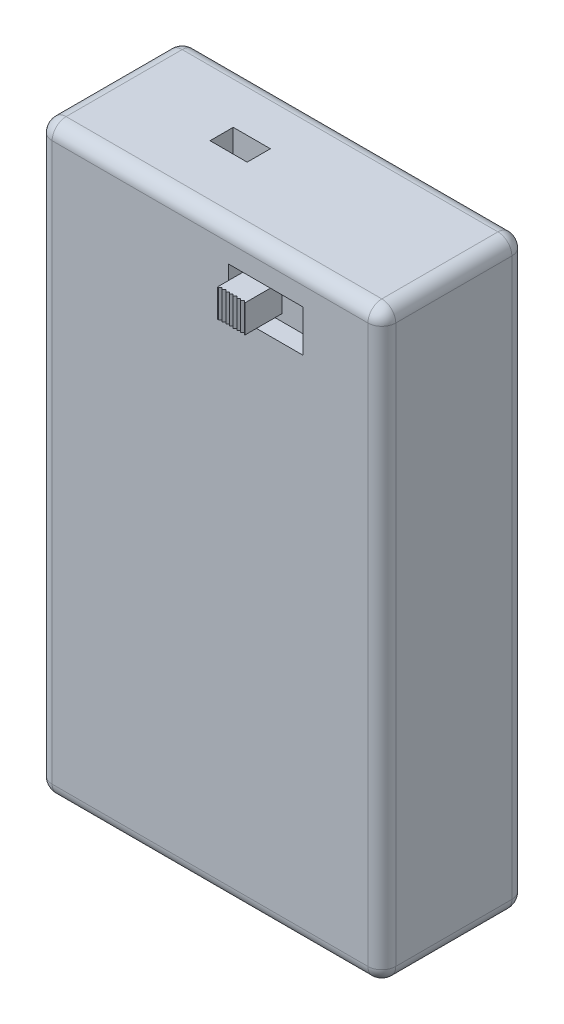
SolidWorks part; units mm, degrees
ref_plane "Plan de face" through (0, 0, 0) normal (0, 0, 1) x (1, 0, 0)
ref_plane "Plan de dessus" through (0, 0, 0) normal (0, 1, 0) x (1, 0, 0)
ref_plane "Plan de droite" through (0, 0, 0) normal (1, 0, 0) x (0, 0, -1)
sketch "Esquisse1" plane through (0, 0, 0) normal (0, 0, 1) x (1, 0, 0)
  line L1 (0, 0) -> (37, 0)
  line L2 (0, 0) -> (0, 63)
  line L3 (0, 63) -> (37, 63)
  line L4 (37, 0) -> (37, 63)
  dimension "D1" = 37
  dimension "D2" = 63
extrude "Boss.-Extru.1" add sketch "Esquisse1" along normal blind 15.5
fillet "Congé1" radius 1.5 12 edges at (0, 0, 7.75) (37, 0, 7.75) (37, 63, 7.75) (0, 63, 7.75) (18.5, 0, 0) (37, 31.5, 0) (18.5, 63, 0) (0, 31.5, 0) (18.5, 63, 15.5) (37, 31.5, 15.5) (18.5, 0, 15.5) (0, 31.5, 15.5)
sketch "Esquisse2" plane through (0, 0, 15.5) normal (0, 0, 1) x (1, 0, 0)
  line L0 (-3.9811, 59.5) -> (43.1878, 59.5) construction
  line L1 (-6.7395, 55) -> (55.4168, 55) construction
  line L2 (28.5, 65.5205) -> (28.5, 47.9586) construction
  line L3 (20.5, 65.5205) -> (20.5, 47.9586) construction
  line L4 (1.5, 63) -> (35.5, 63) construction
  line L5 (37, 61.5) -> (37, 1.5) construction
  line L7 (20.5, 59.5) -> (28.5, 59.5)
  line L8 (20.5, 59.5) -> (20.5, 55)
  line L9 (20.5, 55) -> (28.5, 55)
  line L10 (28.5, 59.5) -> (28.5, 55)
  dimension "D1" = 3.5
  dimension "D2" = 4.5
  dimension "D3" = 8.5
  dimension "D4" = 8
extrude "Enlèv. mat.-Extru.1" cut sketch "Esquisse2" against normal blind 2
sketch "Esquisse3" plane through (0, 0, 13.5) normal (0, 0, 1) x (1, 0, 0)
  line L0 (17.0688, 58.75) -> (25.5005, 58.75) construction
  line L1 (17.8077, 55.75) -> (25.9785, 55.75) construction
  line L2 (21.25, 61.0289) -> (21.25, 53.2926) construction
  line L3 (24.25, 61.0289) -> (24.25, 53.2926) construction
  line L4 (20.5, 55) -> (28.5, 55) construction
  line L5 (20.5, 59.5) -> (20.5, 55) construction
  line L7 (21.2846, 58.75) -> (24.25, 58.75)
  line L8 (21.2846, 58.75) -> (21.2846, 55.75)
  line L9 (21.2846, 55.75) -> (24.25, 55.75)
  line L10 (24.25, 58.75) -> (24.25, 55.75)
  dimension "D1" = 3
  dimension "D2" = 0.75
  dimension "D3" = 3
  dimension "D4" = 0.75
extrude "Boss.-Extru.2" add sketch "Esquisse3" along normal blind 4
sketch "Esquisse4" plane through (0, 58.75, 0) normal (0, 1, 0) x (1, 0, 0)
  line L0 (20.321, -17.5) -> (26.0416, -17.5) construction
  line L1 (20.5223, -17.3) -> (24.6723, -17.3) construction
  line L2 (21.396, -17.5) -> (21.596, -17.3)
  line L3 (21.596, -17.3) -> (21.796, -17.5)
  line L4 (21.796, -17.5) -> (21.996, -17.3)
  line L5 (21.996, -17.3) -> (22.196, -17.5)
  line L6 (22.196, -17.5) -> (22.396, -17.3)
  line L7 (22.396, -17.3) -> (22.596, -17.5)
  line L8 (22.596, -17.5) -> (22.796, -17.3)
  line L9 (22.796, -17.3) -> (22.996, -17.5)
  line L10 (22.996, -17.5) -> (23.196, -17.3)
  line L11 (23.196, -17.3) -> (23.396, -17.5)
  line L12 (23.396, -17.5) -> (23.596, -17.3)
  line L13 (23.596, -17.3) -> (23.796, -17.5)
  line L14 (23.796, -17.5) -> (23.996, -17.3)
  line L15 (23.996, -17.3) -> (24.196, -17.5)
  line L16 (24.196, -17.5) -> (24.196, -17.8294)
  line L17 (24.196, -17.8294) -> (21.396, -17.8294)
  line L18 (21.396, -17.8294) -> (21.396, -17.5)
  dimension "D1" = 0.2
extrude "Enlèv. mat.-Extru.2" cut sketch "Esquisse4" against normal blind 4 and the other way through all
sketch "Esquisse5" plane through (0, 63, 0) normal (0, 1, 0) x (1, 0, 0)
  line L0 (11.5, 2.8921) -> (11.5, -18.3891) construction
  line L1 (15.5, 3.2259) -> (15.5, -18.3891) construction
  line L2 (-4.0539, -6) -> (17.2273, -6) construction
  line L3 (-4.8468, -8.5) -> (17.728, -8.5) construction
  line L4 (0, -14) -> (0, -1.5) construction
  line L5 (1.5, 0) -> (35.5, 0) construction
  line L7 (11.5, -6) -> (15.5, -6)
  line L8 (11.5, -6) -> (11.5, -8.5)
  line L9 (11.5, -8.5) -> (15.5, -8.5)
  line L10 (15.5, -6) -> (15.5, -8.5)
  dimension "D1" = 11.5
  dimension "D2" = 4
  dimension "D3" = 6
  dimension "D4" = 2.5
extrude "Enlèv. mat.-Extru.3" cut sketch "Esquisse5" against normal blind 4
